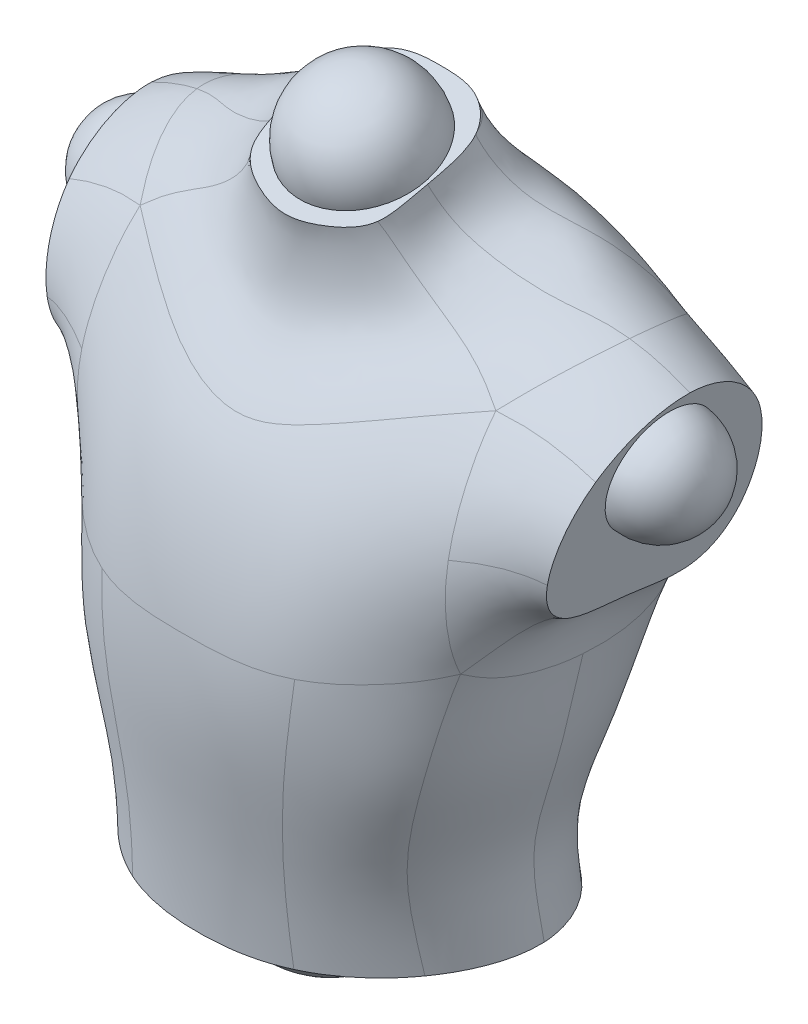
SolidWorks part; units mm, degrees
ref_plane "Front Plane" through (0, 0, 0) normal (0, 0, 1) x (1, 0, 0)
ref_plane "Top Plane" through (0, 0, 0) normal (0, 1, 0) x (1, 0, 0)
ref_plane "Right Plane" through (0, 0, 0) normal (1, 0, 0) x (0, 0, -1)
imported_body "Stock-Source-1"
ref_plane "Plane1" through (0, 0, 76.2) normal (0, 0, 1) x (1, 0, 0)
sketch "Sketch1" plane through (0, 0, 0) normal (1, 0, 0) x (0, 0, -1)
  line L0 (-192.3805, 3802.6899) -> (-65.3805, 3802.6899)
  line L1 (-214.4003, 3802.6899) -> (-170.3607, 3802.6899) construction
  line L2 (-105.012, 3802.6899) -> (-49.9915, 3802.6899) construction
  arc A0 (-65.3805, 3802.6899) -> (-192.3805, 3802.6899) centre (-128.8805, 3802.6899) cw
  dimension "D1" = 63.5
revolve "Revolve1" add sketch "Sketch1" angle 360 about L0
sketch "Sketch2" plane through (0, 0, 0) normal (1, 0, 0) x (0, 0, -1)
  line L0 (-150.5218, 4231.2798) -> (-57.8316, 4261.5302)
  line L1 (-139.4046, 4234.908) -> (-161.6391, 4227.6516) construction
  line L2 (-47.1729, 4265.0087) -> (-68.4903, 4258.0516) construction
  arc A0 (-57.8316, 4261.5302) -> (-150.5218, 4231.2798) centre (-104.1767, 4246.405) ccw
revolve "Revolve2" add sketch "Sketch2" angle 360 about L0
sketch "Sketch3" plane through (0, 0, 76.2) normal (0, 0, 1) x (1, 0, 0)
  line L0 (197.0869, 4157.6049) -> (183.9777, 4078.6761)
  line L3 (193.5151, 4136.0994) -> (197.9684, 4162.9118) construction
  arc A0 (183.9777, 4078.6761) -> (197.0869, 4157.6049) centre (190.5323, 4118.1405) ccw
  dimension "D1" = 80.01
revolve "Revolve3" add sketch "Sketch3" angle 360 about L0
sketch "Sketch4" plane through (0, 0, 76.2) normal (0, 0, 1) x (1, 0, 0)
  line L0 (0.0901, 3802.6899) -> (0.0901, 4052.4104) construction
  line L1 (197.0869, 4157.6049) -> (183.9777, 4078.6761)
  line L2 (197.0869, 4157.6049) -> (183.9777, 4078.6761) construction
  line L3 (-59.1434, 3802.6899) -> (59.3236, 3802.6899) construction
  line L4 (-196.9068, 4157.6049) -> (-183.7975, 4078.6761)
  arc A0 (-183.7975, 4078.6761) -> (-196.9068, 4157.6049) centre (-190.3521, 4118.1405) cw
  arc A1 (183.9777, 4078.6761) -> (197.0869, 4157.6049) centre (190.5323, 4118.1405) ccw
  arc A2 (183.9777, 4078.6761) -> (197.0869, 4157.6049) centre (190.5323, 4118.1405) ccw construction
  dimension "D1" = 0
revolve "Revolve4" add sketch "Sketch4" angle 360 about L4
